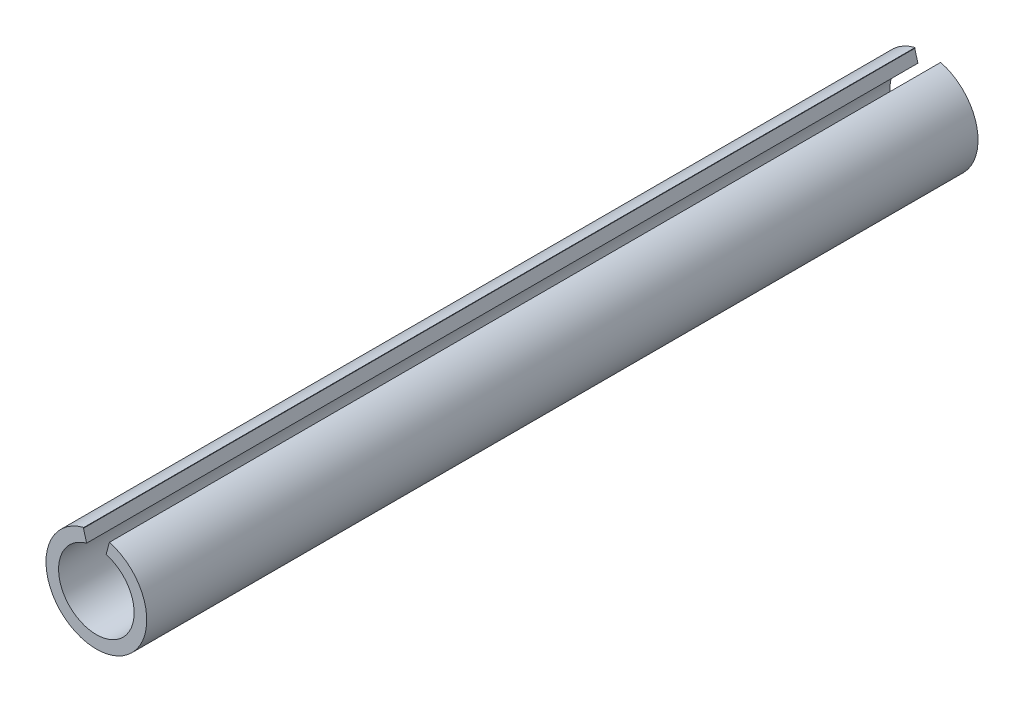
SolidWorks part; units mm, degrees
ref_plane "Face" through (0, 0, 0) normal (0, 0, 1) x (1, 0, 0)
ref_plane "Dessus" through (0, 0, 0) normal (0, 1, 0) x (1, 0, 0)
ref_plane "Droite" through (0, 0, 0) normal (1, 0, 0) x (0, 0, -1)
sketch "Esquisse2" plane through (0, 0, 0) normal (0, 0, 1) x (1, 0, 0)
  circle A0 centre (0, 0) radius 2
  circle A1 centre (0, 0) radius 1.5
  dimension "D1" = 4
  dimension "D2" = 3
extrude "Extrusion1" add sketch "Esquisse2" along normal blind 33
sketch "Esquisse3" plane through (0, 0, 33) normal (0, 0, 1) x (1, 0, 0)
  line L0 (-0.5098, 1.9027) -> (0, 0)
  line L1 (0, 0) -> (0.5176, 1.9319)
  line L2 (0.5176, 1.9319) -> (-0.0964, 2.8916)
  line L3 (-0.0964, 2.8916) -> (-0.5098, 1.9027)
  line L4 (50, 0) -> (-50, 0) construction
  circle A0 centre (0, 0) radius 2 construction
  dimension "D1" = 30
  dimension "D2" = 75
extrude "Enlèv. mat.-Extru.1" cut sketch "Esquisse3" against normal through all
